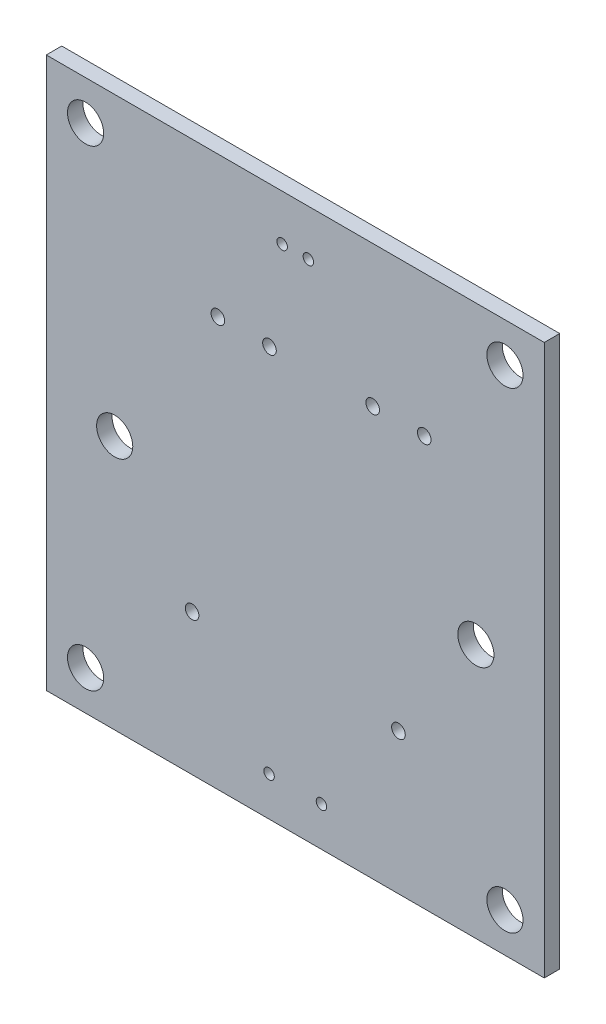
SolidWorks part; units mm, degrees
ref_plane "Front Plane" through (0, 0, 0) normal (0, 0, 1) x (1, 0, 0)
ref_plane "Top Plane" through (0, 0, 0) normal (0, 1, 0) x (1, 0, 0)
ref_plane "Right Plane" through (0, 0, 0) normal (1, 0, 0) x (0, 0, -1)
sketch "Sketch1" plane through (0, 0, 0) normal (0, 0, 1) x (1, 0, 0)
  line L1 (0, 0) -> (48.26, 0)
  line L2 (0, 0) -> (0, -53.34)
  line L3 (0, -53.34) -> (48.26, -53.34)
  line L4 (48.26, 0) -> (48.26, -53.34)
extrude "Boss-Extrude1" add sketch "Sketch1" along normal blind 1.4986
sketch "Sketch2" plane through (0, 0, 1.4986) normal (0, 0, 1) x (1, 0, 0)
  circle A0 centre (3.81, -3.81) radius 1.7526
  circle A1 centre (44.45, -3.81) radius 1.7526
  circle A2 centre (44.45, -49.53) radius 1.7526
  circle A3 centre (3.81, -49.53) radius 1.7526
  circle A4 centre (21.59, -49.53) radius 0.508
  circle A5 centre (26.67, -49.53) radius 0.508
  circle A6 centre (22.86, -4.445) radius 0.508
  circle A7 centre (25.4, -4.445) radius 0.508
  circle A10 centre (16.6294, -13.6703) radius 0.6604
  circle A11 centre (21.6306, -13.6703) radius 0.6604
  circle A12 centre (31.6306, -13.6703) radius 0.6604
  circle A13 centre (36.6293, -13.6703) radius 0.6604
  circle A14 centre (14.13, -39.6697) radius 0.6604
  circle A15 centre (34.13, -39.6697) radius 0.6604
  circle A16 centre (6.6294, -28.669) radius 1.7526
  circle A17 centre (41.6306, -28.669) radius 1.7526
extrude "Cut-Extrude1" cut sketch "Sketch2" against normal up to surface (1.4986 mm away)
